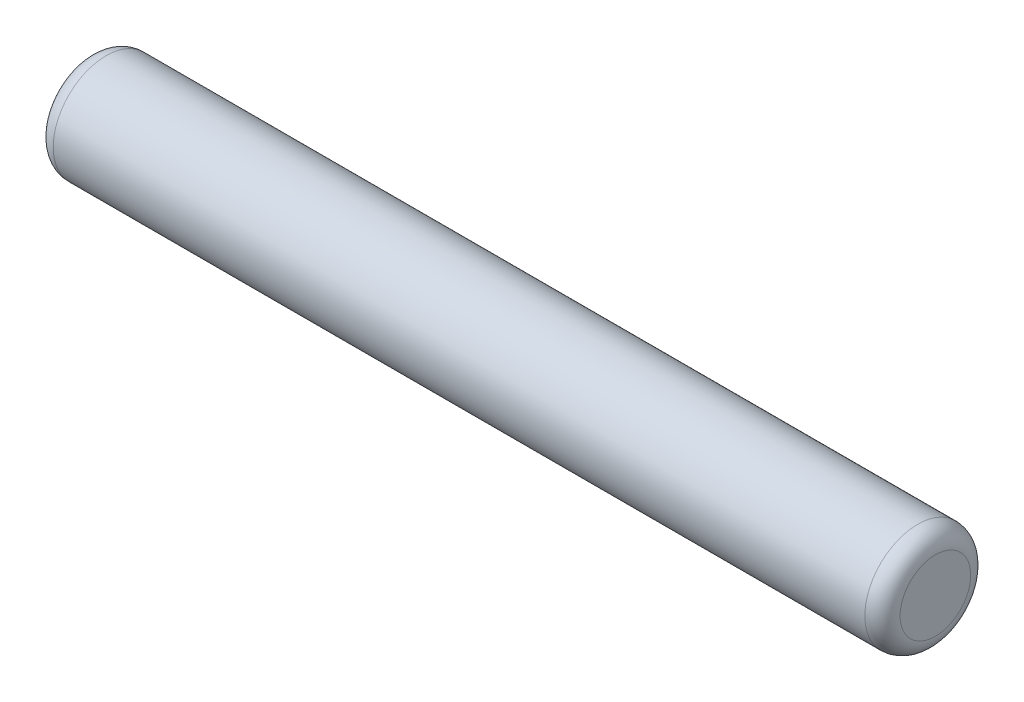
SolidWorks part; units mm, degrees
ref_plane "Спереди" through (0, 0, 0) normal (0, 0, 1) x (1, 0, 0)
ref_plane "Сверху" through (0, 0, 0) normal (0, 1, 0) x (1, 0, 0)
ref_plane "Справа" through (0, 0, 0) normal (1, 0, 0) x (0, 0, -1)
sketch "Эскиз1" plane through (0, 0, 0) normal (1, 0, 0) x (0, 0, -1)
  circle A0 centre (0, 0) radius 1.5
  dimension "D1" = 3
extrude "Бобышка-Вытянуть1" add sketch "Эскиз1" along normal mid plane 24
fillet "Скругление1" radius 0.5 2 edges at (-12, 0, -1.5) (12, 0, -1.5)
